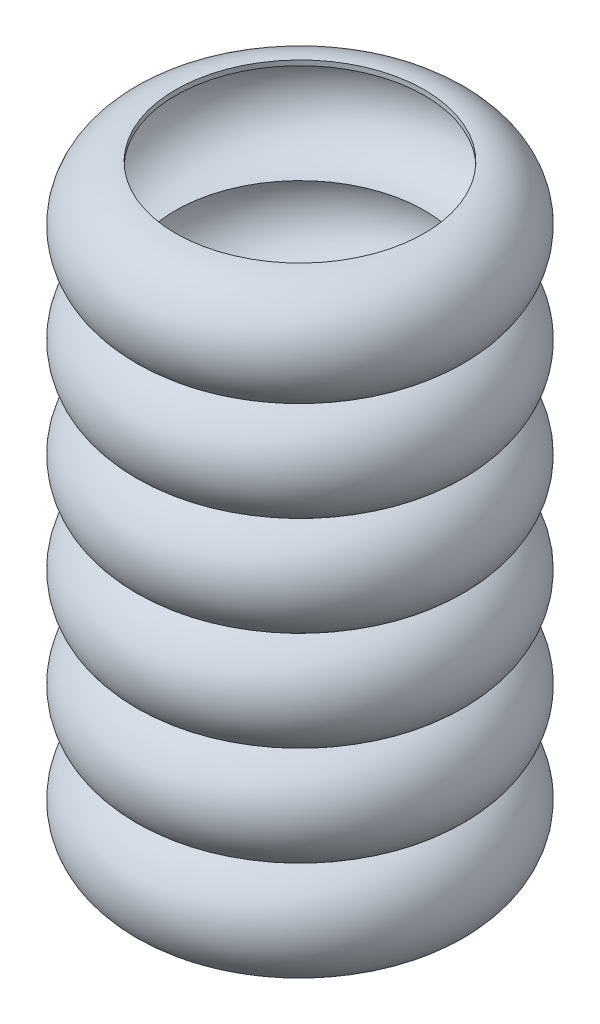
SolidWorks part; units mm, degrees
ref_plane "Front Plane" through (0, 0, 0) normal (0, 0, 1) x (1, 0, 0)
ref_plane "Top Plane" through (0, 0, 0) normal (0, 1, 0) x (1, 0, 0)
ref_plane "Right Plane" through (0, 0, 0) normal (1, 0, 0) x (0, 0, -1)
sketch "Sketch3" plane through (0, 0, 0) normal (0, 1, 0) x (1, 0, 0)
  circle A0 centre (0, 0) radius 25
  dimension "D1" = 50
extrude "Boss-Extrude2" add sketch "Sketch3" along normal blind 120
sketch "Sketch4" plane through (0, 0, 0) normal (0, 0, 1) x (1, 0, 0)
  line L1 (25, 0) -> (25, 120) construction
  line L2 (0, 0) -> (0, 21.4538) construction
  circle A0 centre (25, 10) radius 10
  dimension "D1" = 20
  dimension "D2" = 10
revolve "Revolve1" add sketch "Sketch4" angle 360 about L2
pattern_linear "LPattern1" count 6 spacing 20 along (0, 1, 0) of "Revolve1"
shell "Shell1" thickness 1
